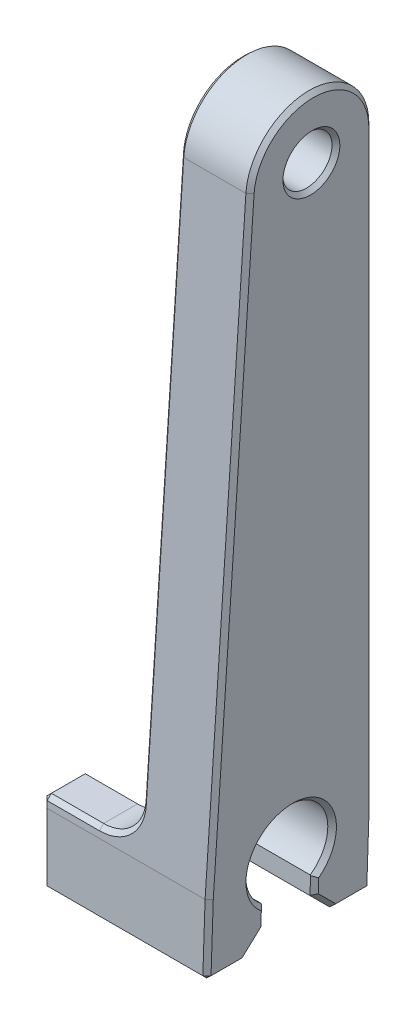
SolidWorks part; units mm, degrees
ref_plane "Спереди" through (0, 0, 0) normal (0, 0, 1) x (1, 0, 0)
ref_plane "Сверху" through (0, 0, 0) normal (0, 1, 0) x (1, 0, 0)
ref_plane "Справа" through (0, 0, 0) normal (1, 0, 0) x (0, 0, -1)
sketch "Эскиз1" plane through (0, 0, 0) normal (1, 0, 0) x (0, 0, -1)
  line L0 (0, -74.3) -> (0, 0) construction
  line L1 (-10, -74.3) -> (-7.4958, 0.2518)
  line L2 (-10, -74.3) -> (0, -74.3) construction
  line L3 (-10, -74.3) -> (-10, -83)
  line L4 (-3, -78.3) -> (-3, -80.5)
  line L5 (-5.5, -83) -> (-10, -83)
  line L6 (-3, -80.5) -> (-5.5, -83)
  line L7 (10, -74.3) -> (10, -83)
  line L8 (10, -74.3) -> (7.4958, 0.2518)
  line L9 (5.5, -83) -> (10, -83)
  line L10 (3, -80.5) -> (5.5, -83)
  line L11 (3, -78.3) -> (3, -80.5)
  circle A0 centre (0, 0) radius 3
  arc A1 (7.4958, 0.2518) -> (-7.4958, 0.2518) centre (0, 0) ccw
  arc A2 (3, -78.3) -> (-3, -78.3) centre (0, -74.3) ccw
  point P10 (-3, -83)
  dimension "D1" = 6
  dimension "D2" = 15
  dimension "D3" = 10
  dimension "D4" = 74.3
  dimension "D5" = 20
  dimension "D6" = 6
  dimension "D7" = 83
  dimension "D11" = 2.5
extrude "Бобышка-Вытянуть1" add sketch "Эскиз1" along normal blind 23
sketch "Эскиз2" plane through (0, 0, 0) normal (0, 0, 1) x (1, 0, 0)
  line L0 (0, -73) -> (0, 7.5)
  line L1 (0, 0.2518) -> (0, -74.3) construction
  line L2 (0, -73) -> (6.8779, -73)
  line L3 (23, -83) -> (0, -83) construction
  line L4 (23, 7.5) -> (19.9978, -83)
  line L5 (23, 0.2518) -> (23, -74.3) construction
  line L6 (19.9978, -83) -> (23, -83)
  line L7 (23, -83) -> (23, 7.5)
  line L8 (14.3853, 7.5) -> (11.8752, -68.1658)
  line L9 (0, 7.5) -> (14.3853, 7.5)
  arc A0 (6.8779, -73) -> (11.8752, -68.1658) centre (6.8779, -68) ccw
  dimension "D4" = 5
  dimension "D1" = 10
  dimension "D2" = 1.9
  dimension "D3" = 8.61
extrude "Вырез-Вытянуть1" cut sketch "Эскиз2" against normal mid plane 23
chamfer "Фаска1" distance 0.5 angle 45 40 edges at (20.0393, -81.75, 4.25) (19.9978, -83, 7.75) (21.523, -37.0241, 8.7479) (23, 7.5, 0) (21.523, -37.0241, -8.7479) (19.9978, -83, -7.75) (20.0393, -81.75, -4.25) (20.1172, -79.4, -3) (20.4523, -69.3, 0) (20.1172, -79.4, 3) (22.6517, -3, 0) (3.439, -73, 9.9563) (3.439, -73, -9.9563) (10.3543, -71.5937, 9.9091) (10.3543, -71.5937, -9.9091) (13.01, -33.957, 8.6449) (13.01, -33.957, -8.6449) (14.3853, 7.5, 0) (14.0369, -3, 0) (3.439, -73, 4.828) (3.439, -73, -4.828) (2.0656, -69.357, -0.7525) (0, -79.4, -3) (0, -81.75, -4.25) (0, -83, -7.75) (0, -75.9303, -4.7267) (0, -73, -7.3922) (0, -73.65, -9.9782) (0, -78.65, -10) (20.1421, -78.65, -10) (9.9989, -83, -10) (0, -78.65, 10) (0, -73.65, 9.9782) (0, -73, 7.3922) (0, -75.9303, 4.7267) (0, -79.4, 3) (0, -81.75, 4.25) (0, -83, 7.75) (20.1421, -78.65, 10) (9.9989, -83, 10)
